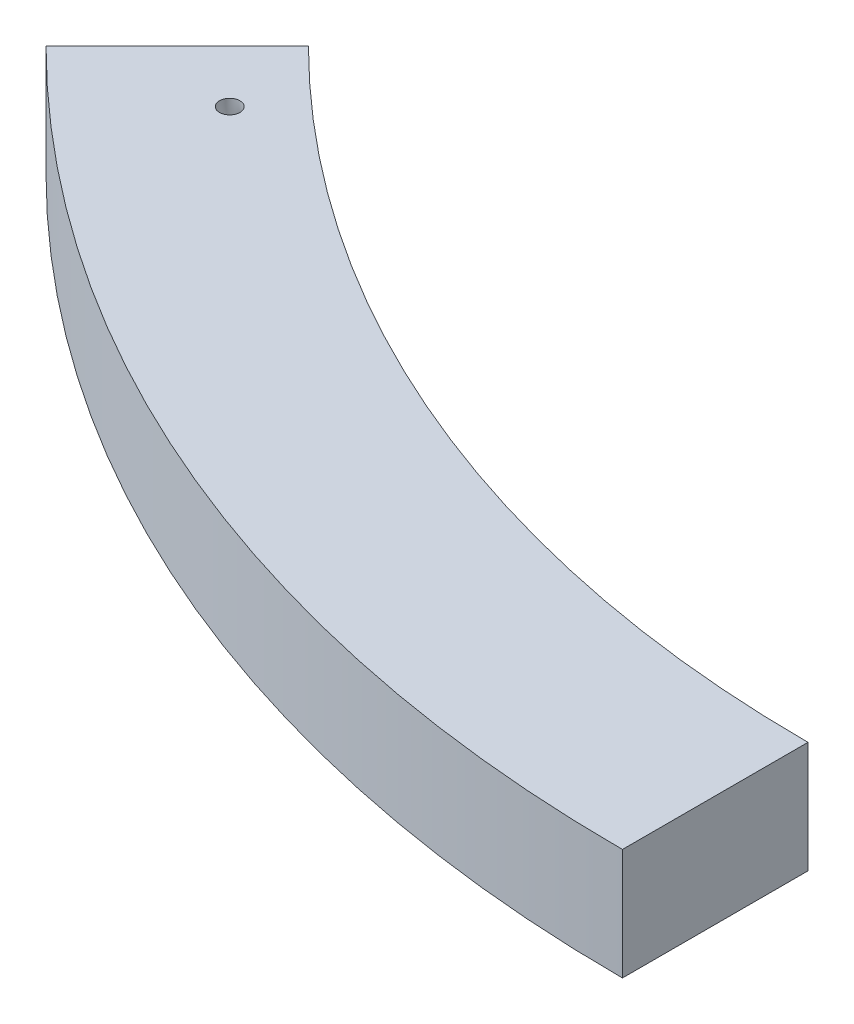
SolidWorks part; units mm, degrees
ref_plane "Front Plane" through (0, 0, 0) normal (0, 0, 1) x (1, 0, 0)
ref_plane "Top Plane" through (0, 0, 0) normal (0, 1, 0) x (1, 0, 0)
ref_plane "Right Plane" through (0, 0, 0) normal (1, 0, 0) x (0, 0, -1)
sketch "Sketch3" plane through (0, 0, 0) normal (0, 1, 0) x (1, 0, 0)
  line L0 (0, 0) -> (0, -3750)
  line L1 (0, 0) -> (-2651.6504, -2651.6504)
  arc A0 (-2651.6504, -2651.6504) -> (0, -3750) centre (0, 0) ccw
  arc A1 (-2298.097, -2298.097) -> (0, -3250) centre (0, 0) ccw
  dimension "D1" = 7500
  dimension "D2" = 500
  dimension "D3" = 45
extrude "Boss-Extrude2" add sketch "Sketch3" along normal blind 300 contours A1 L1 A0 L0
sketch "Sketch5" plane through (0, 0, 0) normal (1, 0, 0) x (0, 0, -1)
  circle A0 centre (-3250, 300) radius 75 construction
  dimension "D1" = 150
sketch "Sketch7" plane through (0, 300, 0) normal (0, 1, 0) x (1, 0, 0)
  line L0 (-2298.097, -2298.097) -> (-2404.1631, -2404.1631) construction
  line L1 (-2298.097, -2298.097) -> (-2651.6504, -2651.6504) construction
  line L2 (-2298.097, -2298.097) -> (-2156.6757, -2439.5184) construction
  circle A0 centre (-2262.7417, -2545.5844) radius 27.5
  dimension "D1" = 55
  dimension "D2" = 150
  dimension "D3" = 200
  dimension "D4" = 90
  dimension "D5" = 200
  dimension "D6" = 150
revolve "Cut-Revolve2" cut sketch "Sketch7" angle 360 about L2
